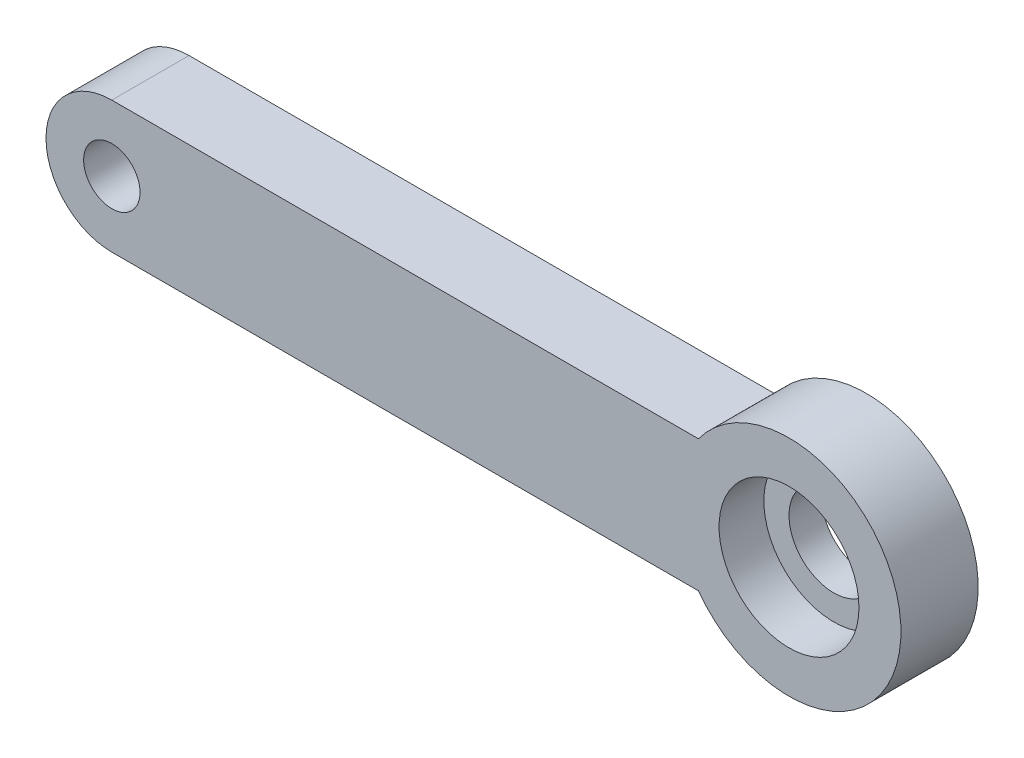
SolidWorks part; units mm, degrees
ref_plane "Front Plane" through (0, 0, 0) normal (0, 0, 1) x (1, 0, 0)
ref_plane "Top Plane" through (0, 0, 0) normal (0, 1, 0) x (1, 0, 0)
ref_plane "Right Plane" through (0, 0, 0) normal (1, 0, 0) x (0, 0, -1)
sketch "Sketch1" plane through (0, 0, 0) normal (0, 0, 1) x (1, 0, 0)
  line L3 (-76.835, 7.47) -> (-10.2708, 7.47)
  line L4 (-76.835, -7.47) -> (-10.2708, -7.47)
  circle A0 centre (0, 0) radius 7.9375 construction
  circle A1 centre (0, 0) radius 5.08
  circle A2 centre (-76.835, 0) radius 3.2004
  arc A4 (-76.835, -7.47) -> (-76.835, 7.47) centre (-76.835, 0) cw
  arc A5 (-10.2708, 7.47) -> (-10.2708, -7.47) centre (0, 0) cw
  dimension "D1" = 76.835
extrude "Boss-Extrude1" add sketch "Sketch1" along normal blind 8.763
sketch "Sketch2" plane through (0, 0, 8.763) normal (0, 0, 1) x (1, 0, 0)
  circle A0 centre (0, 0) radius 7.9375
extrude "Cut-Extrude1" cut sketch "Sketch2" against normal blind 5.08
